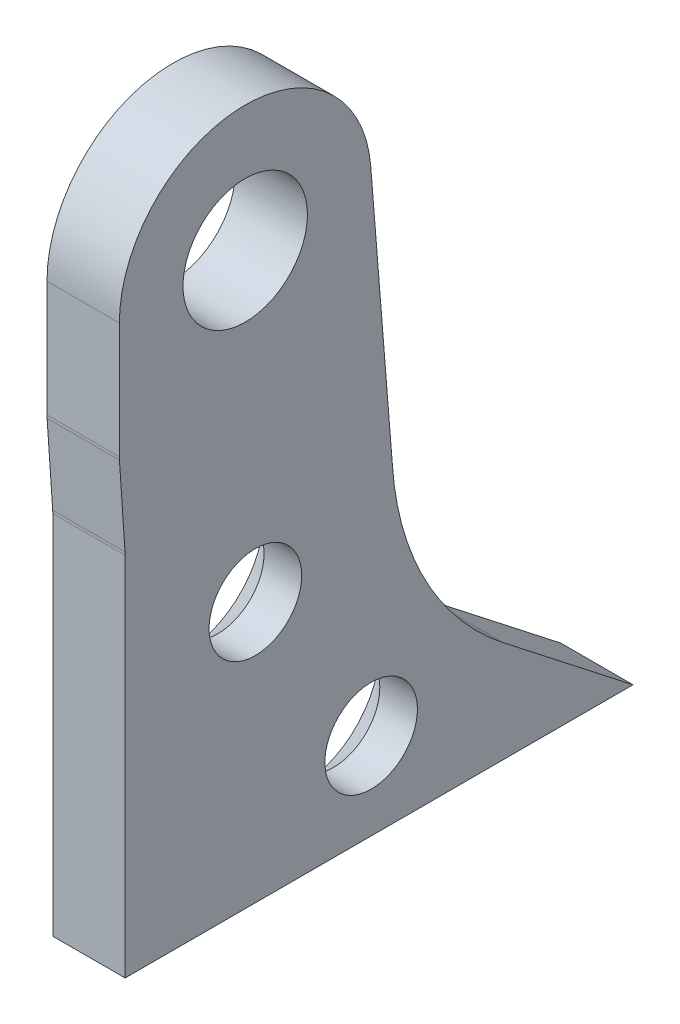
SolidWorks part; units mm, degrees
other "<PLACA_CHUTE_ALTO_met_cap>-<Filete1>"
ref_plane "Front Plane" through (0, 0, 0) normal (0, 0, 1) x (1, 0, 0)
ref_plane "Top Plane" through (0, 0, 0) normal (0, 1, 0) x (1, 0, 0)
ref_plane "Right Plane" through (0, 0, 0) normal (1, 0, 0) x (0, 0, -1)
mirrored part "PLACA_CHUTE_ALTO_met_cap_Mirrored"
